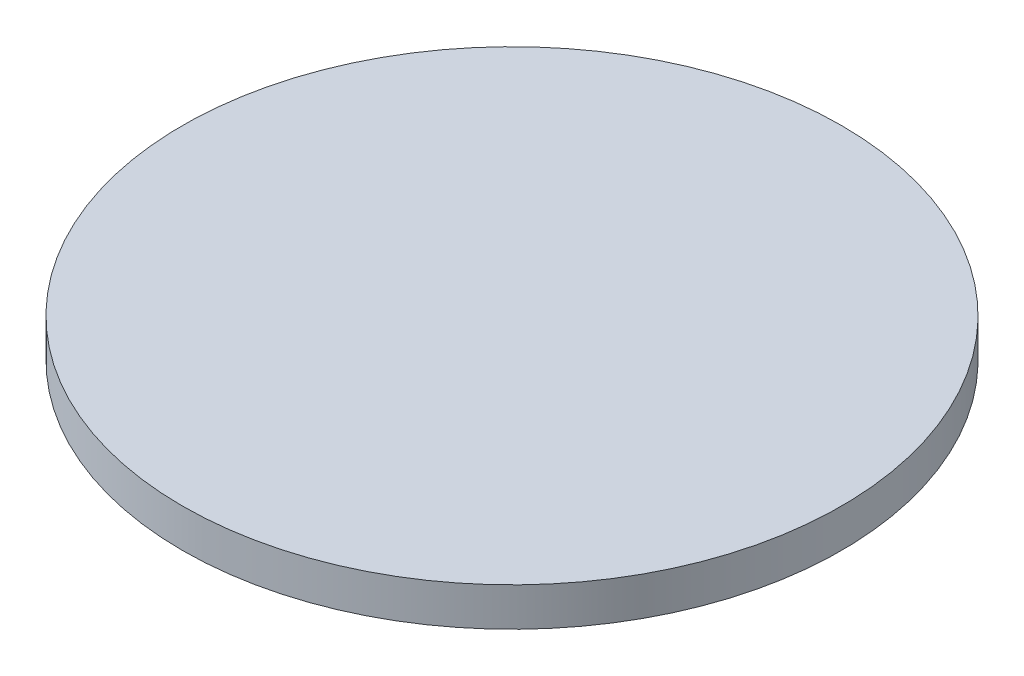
SolidWorks part; units mm, degrees
ref_plane "Front Plane" through (0, 0, 0) normal (0, 0, 1) x (1, 0, 0)
ref_plane "Top Plane" through (0, 0, 0) normal (0, 1, 0) x (1, 0, 0)
ref_plane "Right Plane" through (0, 0, 0) normal (1, 0, 0) x (0, 0, -1)
sketch "Sketch1" plane through (0, 0, 0) normal (0, 1, 0) x (1, 0, 0)
  circle A0 centre (0, 0) radius 27.178
  dimension "D1" = 54.356
extrude "Boss-Extrude1" add sketch "Sketch1" along normal blind 3.175
